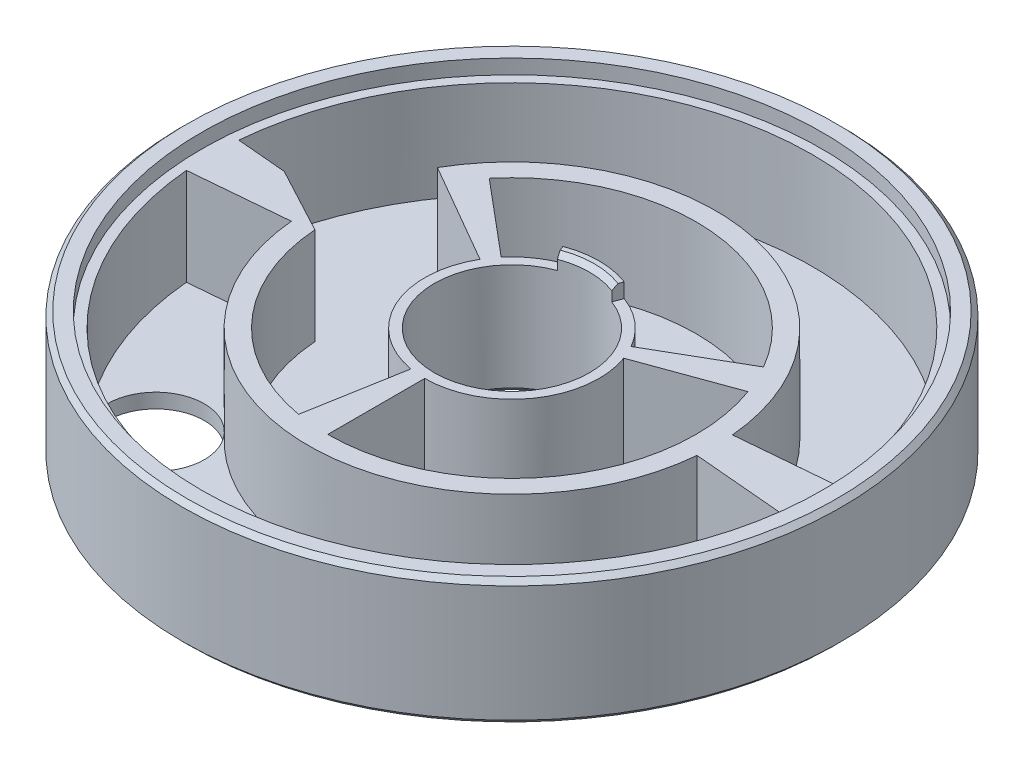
SolidWorks part; units mm, degrees
ref_plane "Front Plane" through (0, 0, 0) normal (0, 0, 1) x (1, 0, 0)
ref_plane "Top Plane" through (0, 0, 0) normal (0, 1, 0) x (1, 0, 0)
ref_plane "Right Plane" through (0, 0, 0) normal (1, 0, 0) x (0, 0, -1)
sketch "Sketch1" plane through (0, 0, 0) normal (0, 1, 0) x (1, 0, 0)
  circle A0 centre (0, 0) radius 8
  circle A1 centre (0, 0) radius 20 construction
  circle A2 centre (0, 0) radius 34
  circle A3 centre (0, 0) radius 14 construction
  circle A4 centre (0, 0) radius 26 construction
  point P7 (0, -14)
  point P8 (0, -26)
extrude "Boss-Extrude1" add sketch "Sketch1" against normal blind 13
sketch "Sketch2" plane through (0, 0, 0) normal (0, 1, 0) x (1, 0, 0)
  line L0 (0, 8) -> (-3, 8) construction
  line L1 (0, 8) -> (3, 8) construction
  line L2 (0, 0) -> (-3, 8) construction
  line L3 (-3, 8) -> (-4.1545, 11.0787) construction
  line L4 (0, 0) -> (3, 8) construction
  line L5 (3, 8) -> (4.1545, 11.0787) construction
  line L6 (-2.809, 7.4906) -> (-3.1601, 8.427)
  line L7 (2.809, 7.4906) -> (3.1601, 8.427)
  circle A0 centre (0, 0) radius 32
  arc A1 (-2.809, 7.4906) -> (2.809, 7.4906) centre (0, 0) ccw
  arc A2 (3.1601, 8.427) -> (-3.1601, 8.427) centre (0, 0) ccw
extrude "Cut-Extrude1" cut sketch "Sketch2" against normal blind 1.5
chamfer "Chamfer1" distance 0.5 angle 45 4 edges at (0, 0, 34) (0, -13, 34) (0, -13, 8) (0, 0, -8)
sketch "Sketch3" plane through (0, 0, 0) normal (1, 0, 0) x (0, 0, -1)
  line L0 (-14, 0) -> (-14, -12.9052) construction
  line L1 (-26, 0) -> (-26, -12.9052) construction
  line L2 (-14, 0) -> (-19, 0)
  line L3 (26, 0) -> (-26, 0) construction
  line L4 (-19, 0) -> (-19, -11.5)
  line L5 (-19, -11.5) -> (-9, -11.5)
  line L6 (-9, -11.5) -> (-9, 0)
  line L7 (-9, 0) -> (-14, 0)
ref_axis "Axis1" through (0, -12.5, 0) along (0, 1, 0)
revolve "Cut-Revolve1" cut sketch "Sketch3" angle 110 about axis through (0, -12.5, 0) along (0, 1, 0)
pattern_circular "CirPattern1" count 3 over 360 about axis through (0, 0, 0) along (0, 1, 0) of "Cut-Revolve1"
sketch "Sketch4" plane through (0, 0, 0) normal (1, 0, 0) x (0, 0, -1)
  line L0 (-26, 0) -> (-26, -12.8757) construction
  line L1 (-26, 0) -> (-31, 0)
  line L2 (34, 0) -> (-34, 0) construction
  line L3 (-31, 0) -> (-31, -11.5)
  line L4 (-31, -11.5) -> (-21, -11.5)
  line L5 (-21, -11.5) -> (-21, 0)
  line L6 (-21, 0) -> (-26, 0)
revolve "Cut-Revolve2" cut sketch "Sketch4" angle 170 mid plane about axis through (0, -12.5, 0) along (0, 1, 0)
pattern_circular "CirPattern2" count 2 over 360 about axis through (0, 0, 0) along (0, 1, 0) of "Cut-Revolve2"
sketch "Sketch5" plane through (0, 0, 0) normal (0, 1, 0) x (1, 0, 0)
  line L0 (-32, 0) -> (-19, 0) construction
  line L1 (-14.5548, 12.213) -> (-16.4545, 9.5) construction
  line L2 (-15.5047, 10.8565) -> (-6.5532, 4.5886) construction
  line L3 (-16.4545, 9.5) -> (-21.5292, 0) construction
  line L4 (-21.5292, 0) -> (-17.8373, -1.9721) construction
  line L5 (-16.4545, 9.5) -> (-19.7701, 11.4143)
  line L6 (-17.8373, -1.9721) -> (-21.5292, 0)
  line L7 (-21.5292, 0) -> (-27.1921, 3.025)
  line L8 (-27.1921, 3.025) -> (-19.7701, 11.4143)
  line L9 (-17.8373, -1.9721) -> (-16.4545, 9.5)
  circle A0 centre (0, 0) radius 32 construction
  arc A1 (-16.4545, 9.5) -> (-3.2993, -18.7113) centre (0, 0) ccw construction
  circle A2 centre (0, 0) radius 8 construction
extrude "Cut-Extrude2" cut sketch "Sketch5" against normal up to surface (11.5 mm away)
sketch "Sketch6" plane through (0, -11.5, 0) normal (0, 1, 0) x (1, 0, 0)
  line L0 (30.882, 2.7018) -> (20.9201, 1.8303) construction
  circle A0 centre (0, 0) radius 26 construction
  circle A1 centre (24.9534, 7.3026) radius 5
  circle A2 centre (13.9709, -0.9019) radius 5
  circle A3 centre (0, 0) radius 14 construction
  circle A4 centre (-19.1098, -17.63) radius 5
  point P1 (24.9534, 7.3026)
  dimension "D1" = 5.1
extrude "Cut-Extrude3" cut sketch "Sketch6" against normal through all
